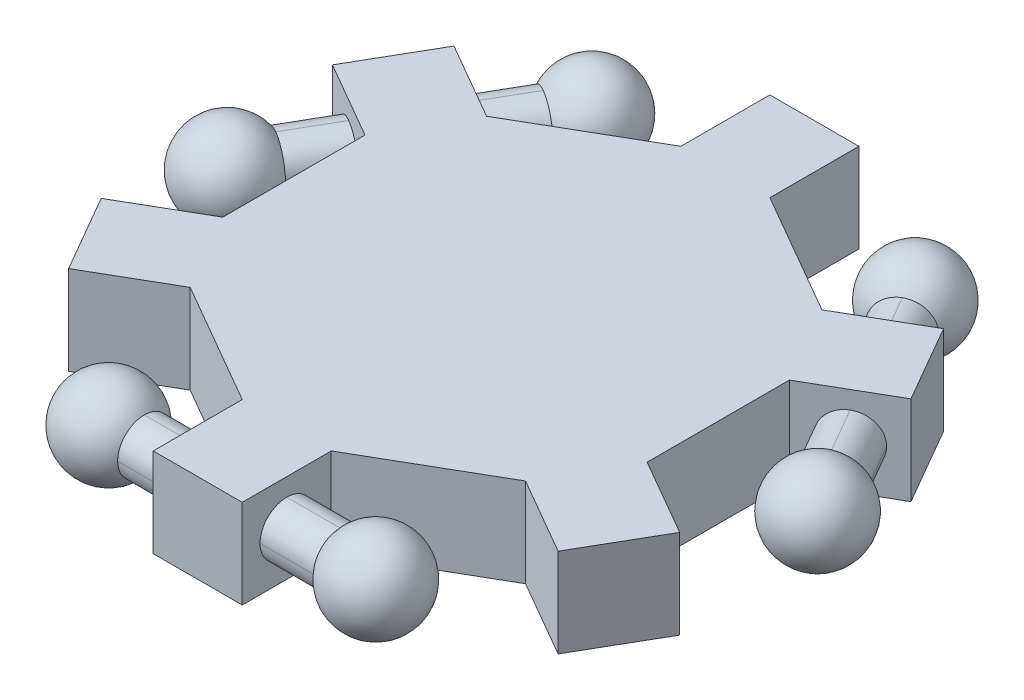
SolidWorks part; units mm, degrees
ref_plane "Front Plane" through (0, 0, 0) normal (0, 0, 1) x (1, 0, 0)
ref_plane "Top Plane" through (0, 0, 0) normal (0, 1, 0) x (1, 0, 0)
ref_plane "Right Plane" through (0, 0, 0) normal (1, 0, 0) x (0, 0, -1)
sketch "Sketch1" plane through (0, 0, 0) normal (0, 1, 0) x (1, 0, 0)
  line L0 (0, 210) -> (297, 0) construction
  line L1 (0, 0) -> (297, 0) construction
  line L2 (0, 0) -> (0, 210) construction
  line L3 (0, 210) -> (297, 210) construction
  line L4 (297, 0) -> (297, 210) construction
  line L5 (0, 0) -> (297, 210) construction
  dimension "D1" = 210
  dimension "D2" = 297
sketch "Sketch2" plane through (0, 0, 0) normal (0, 1, 0) x (1, 0, 0)
  line L0 (128.5, 139.641) -> (168.5, 139.641)
  line L1 (168.5, 139.641) -> (188.5, 105)
  line L2 (188.5, 105) -> (168.5, 70.359)
  line L3 (168.5, 70.359) -> (128.5, 70.359)
  line L4 (128.5, 70.359) -> (108.5, 105)
  line L5 (108.5, 105) -> (128.5, 139.641)
  line L6 (128.5, 139.641) -> (168.5, 70.359) construction
  line L7 (128.5, 70.359) -> (168.5, 139.641) construction
  line L8 (108.5, 105) -> (188.5, 105) construction
  line L9 (0, 0) -> (297, 0) construction
  line L10 (0, 210) -> (297, 0) construction
  line L11 (153.5, 139.641) -> (153.5, 129.641)
  line L12 (153.5, 129.641) -> (167.3397, 121.6506)
  line L13 (167.3397, 121.6506) -> (176, 126.6506)
  line L14 (143.5, 139.641) -> (143.5, 129.641)
  line L15 (143.5, 129.641) -> (129.6603, 121.6506)
  line L16 (129.6603, 121.6506) -> (121, 126.6506)
  line L17 (116, 117.9904) -> (128.9904, 110.4904)
  line L18 (128.9904, 110.4904) -> (124.6603, 97.0096)
  line L19 (124.6603, 97.0096) -> (116, 92.0096)
  line L20 (181, 117.9904) -> (172.3397, 112.9904)
  line L21 (172.3397, 112.9904) -> (172.3397, 97.0096)
  line L22 (172.3397, 97.0096) -> (181, 92.0096)
  line L23 (176, 83.3494) -> (167.3397, 88.3494)
  line L24 (167.3397, 88.3494) -> (153.5, 80.359)
  line L25 (153.5, 80.359) -> (153.5, 70.359)
  line L26 (121, 83.3494) -> (129.6603, 88.3494)
  line L27 (129.6603, 88.3494) -> (143.5, 80.359)
  line L28 (143.5, 80.359) -> (143.5, 70.359)
  point P2 (148.5, 105)
  point P11 (148.5, 105)
  dimension "D1" = 120
  dimension "D2" = 120
  dimension "D3" = 120
  dimension "D4" = 120
  dimension "D5" = 40
  dimension "D6" = 40
  dimension "D7" = 40
  dimension "D8" = 105
  dimension "D9" = 0
  dimension "D10" = 90
  dimension "D11" = 15
  dimension "D12" = 15
  dimension "D13" = 15
  dimension "D14" = 15
  dimension "D15" = 10
  dimension "D16" = 10
  dimension "D17" = 10
  dimension "D18" = 90
  dimension "D19" = 90
  dimension "D20" = 90
  dimension "D21" = 90
  dimension "D22" = 90
  dimension "D23" = 15
  dimension "D24" = 15
  dimension "D25" = 15
  dimension "D26" = 15
  dimension "D27" = 15
  dimension "D28" = 90
  dimension "D29" = 90
  dimension "D30" = 10
  dimension "D31" = 90
  dimension "D32" = 90
  dimension "D33" = 90
  dimension "D34" = 90
  dimension "D35" = 90
  dimension "D36" = 10
  dimension "D37" = 10
  dimension "D38" = 10
  dimension "D39" = 10
  dimension "D40" = 15
  dimension "D41" = 10
  dimension "D42" = 10
extrude "Boss-Extrude1" add sketch "Sketch2" along normal blind 10 contours L27 L28 L3 L25 L24 L23 L2 L22 L21 L20 L1 L13 L12 L11 L0 L14 L15 L16 L5 L17 L18 L19 L4 L26
sketch "Sketch3" plane through (153.5, 0, 0) normal (1, 0, 0) x (0, 0, -1)
  line L1 (0, 0) -> (210, 0) construction
  line L2 (80.359, 10) -> (80.359, 0) construction
  line L3 (72.359, 8) -> (78.359, 8)
  line L4 (72.359, 8) -> (72.359, 2)
  line L5 (72.359, 2) -> (78.359, 2)
  line L6 (78.359, 8) -> (78.359, 2)
  line L7 (72.359, 8) -> (78.359, 2) construction
  line L8 (78.359, 8) -> (72.359, 2) construction
  dimension "D1" = 6
  dimension "D2" = 6
  dimension "D3" = 2
  dimension "D4" = 2
extrude "Boss-Extrude2" add sketch "Sketch3" along normal blind 10
fillet "Fillet1" radius 3 4 edges at (158.5, 8, -72.359) (158.5, 2, -72.359) (158.5, 2, -78.359) (158.5, 8, -78.359)
sketch "Sketch4" plane through (163.5, 0, 0) normal (1, 0, 0) x (0, 0, -1)
  line L0 (70.359, 5) -> (80.359, 5)
  line L1 (72.359, 8) -> (78.359, 2) construction
  arc A0 (80.359, 5) -> (70.359, 5) centre (75.359, 5) ccw
  point P4 (0, 0)
  point P7 (75.359, 5)
  dimension "D2" = 0
  dimension "D1" = 0
revolve "Revolve1" add sketch "Sketch4" angle 360 about L0
ref_plane "Plane1" through (148.5, 0, 0) normal (-1, 0, 0) x (0, 0, 1)
ref_plane "Plane2" through (-8.3413, 0, -14.4476) normal (0.5, 0, 0.866) x (0.866, 0, -0.5)
mirror "Mirror1" about plane through (148.5, 0, 0) normal (-1, 0, 0)
mirror "Mirror2" about plane through (-8.3413, 0, -14.4476) normal (0.5, 0, 0.866)
mirror "Mirror3" about plane through (148.5, 0, 0) normal (-1, 0, 0)
